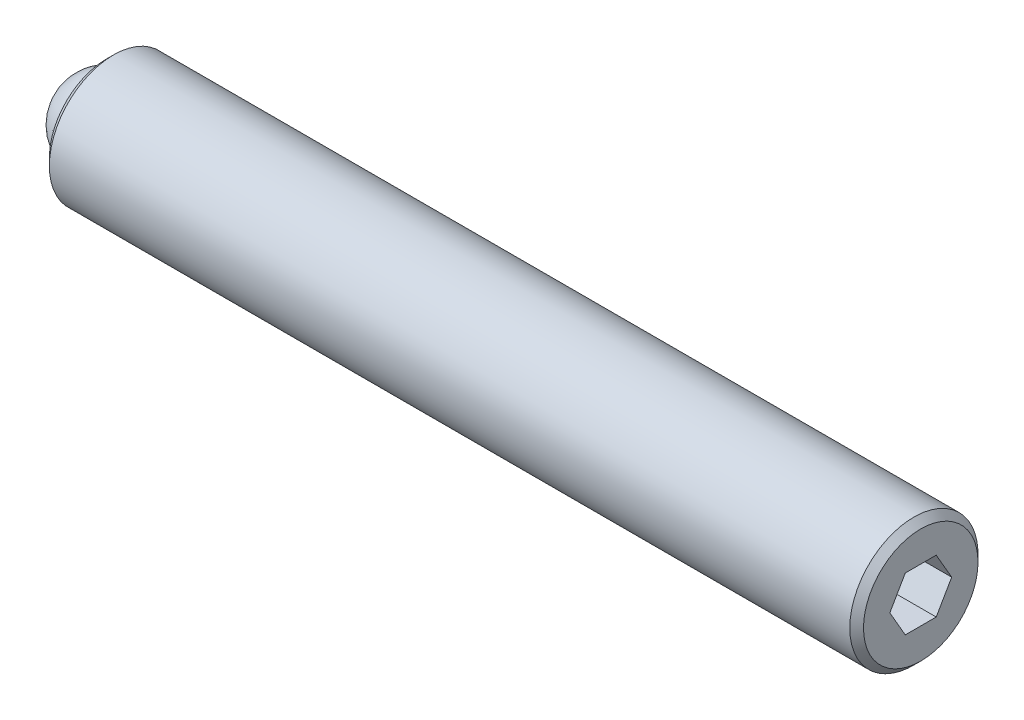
SolidWorks part; units mm, degrees
ref_plane "Front Plane" through (0, 0, 0) normal (0, 0, 1) x (1, 0, 0)
ref_plane "Top Plane" through (0, 0, 0) normal (0, 1, 0) x (1, 0, 0)
ref_plane "Right Plane" through (0, 0, 0) normal (1, 0, 0) x (0, 0, -1)
sketch "Sketch2" plane through (0, 0, 0) normal (1, 0, 0) x (0, 0, -1)
  circle A0 centre (0, 0) radius 2.3749
  dimension "D1" = 4.7498
extrude "Boss-Extrude1" add sketch "Sketch2" along normal blind 30.1625
sketch "Sketch3" plane through (0, 0, 0) normal (-1, 0, 0) x (0, 0, 1)
  circle A0 centre (0, 0) radius 1.5875
  dimension "D1" = 3.175
chamfer "Chamfer1" distance 0.254 angle 45 1 edges at (0, 0, -2.3749)
chamfer "Chamfer2" distance 0.254 angle 45 1 edges at (30.1625, 0, -2.3749)
sketch "Sketch4" plane through (30.1625, 0, 0) normal (1, 0, 0) x (0, 0, -1)
  line L1 (1.1457, 0) -> (0.5728, 0.9922)
  line L2 (0.5728, 0.9922) -> (-0.5728, 0.9922)
  line L3 (-0.5728, 0.9922) -> (-1.1457, 0)
  line L4 (-1.1457, 0) -> (-0.5728, -0.9922)
  line L5 (-0.5728, -0.9922) -> (0.5728, -0.9922)
  line L6 (0.5728, -0.9922) -> (1.1457, 0)
  circle A0 centre (0, 0) radius 0.9922 construction
extrude "Cut-Extrude2" cut sketch "Sketch4" against normal blind 2.286
extrude "Cut-Extrude3" cut sketch "Sketch3" against normal blind 1.5875
sketch "Sketch5" plane through (0, 0, 0) normal (-1, 0, 0) x (0, 0, 1)
  line L0 (0, 0) -> (0, -1.5875)
  line L1 (0, 0) -> (0, 1.5875)
  arc A0 (0, 1.5875) -> (0, -1.5875) centre (0, 0) ccw
revolve "Revolve1" add sketch "Sketch5" angle 360 about L1
